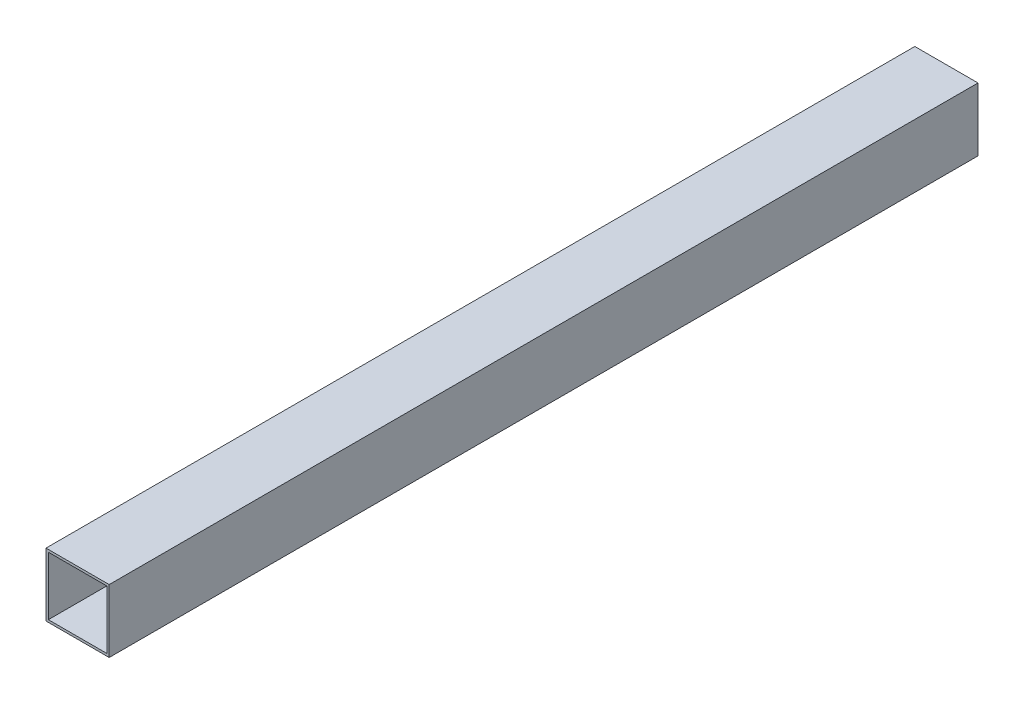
SolidWorks part; units mm, degrees
ref_plane "Plan de face" through (0, 0, 0) normal (0, 0, 1) x (1, 0, 0)
ref_plane "Plan de dessus" through (0, 0, 0) normal (0, 1, 0) x (1, 0, 0)
ref_plane "Plan de droite" through (0, 0, 0) normal (1, 0, 0) x (0, 0, -1)
sketch "Esquisse1" plane through (0, 0, 0) normal (0, 0, 1) x (1, 0, 0)
  line L1 (0, 80) -> (80, 80)
  line L2 (0, 80) -> (0, 0)
  line L3 (0, 0) -> (80, 0)
  line L4 (80, 80) -> (80, 0)
  line L5 (3, 77) -> (77, 77)
  line L6 (3, 77) -> (3, 3)
  line L7 (3, 3) -> (77, 3)
  line L8 (77, 77) -> (77, 3)
  dimension "D1" = 80
  dimension "D2" = 80
  dimension "D3" = 3
  dimension "D4" = 3
  dimension "D5" = 3
  dimension "D6" = 3
extrude "Extrusion1" add sketch "Esquisse1" along normal blind 1100
ref_plane "Plan1" through (0, 0, 550) normal (0, 0, 1) x (1, 0, 0)
